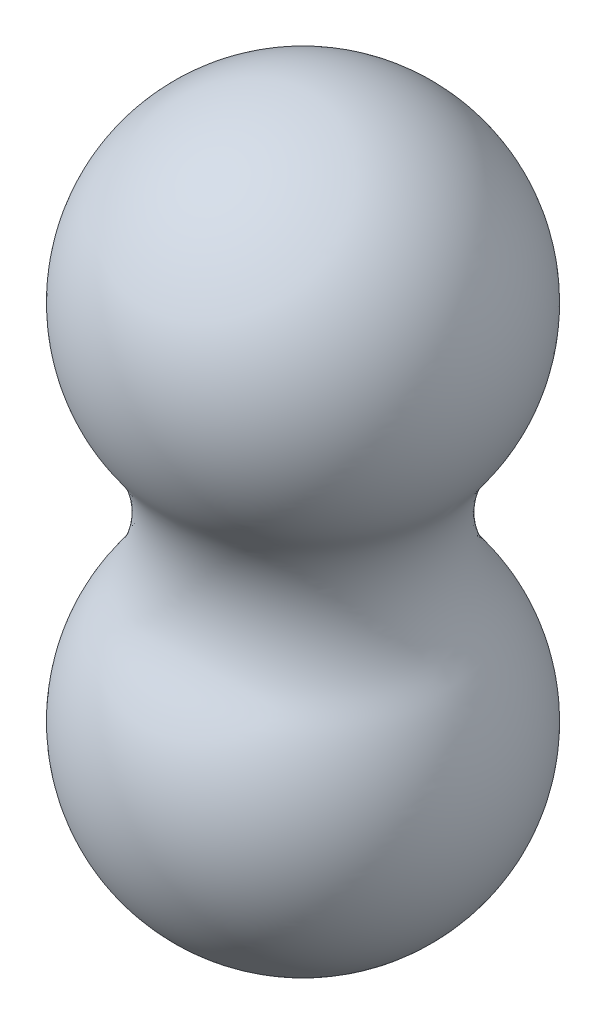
SolidWorks part; units mm, degrees
ref_plane "Płaszczyzna przednia" through (0, 0, 0) normal (0, 0, 1) x (1, 0, 0)
ref_plane "Płaszczyzna górna" through (0, 0, 0) normal (0, 1, 0) x (1, 0, 0)
ref_plane "Płaszczyzna prawa" through (0, 0, 0) normal (1, 0, 0) x (0, 0, -1)
sketch "Szkic5" plane through (0, 0, 0) normal (0, 0, 1) x (1, 0, 0)
  line L0 (0, 0) -> (0, 60)
  arc A0 (0, 60) -> (12, 36) centre (0, 45) cw construction
  arc A1 (12, 36) -> (12, 24) centre (20, 30) ccw construction
  arc A2 (12, 24) -> (0, 0) centre (0, 15) cw construction
  spline S0 degree 3 poles (0, 0) (12.1152, 0) (18.6714, 10.1879) (13.6521, 21.2145) (13.3557, 21.8658) (12.6695, 23.1258) (11.3377, 24.8498) (10.7394, 26.1589) (10.5132, 26.8377) (9.8229, 28.9086) (9.8229, 31.0914) (10.5132, 33.1623) (10.7394, 33.8411) (11.3377, 35.1502) (12.6695, 36.8742) (13.3557, 38.1342) (13.6521, 38.7855) (18.6714, 49.8121) (12.1152, 60) (0, 60) knots 0 0 0 0 0.362155 0.362155 0.362155 0.392971 0.423788 0.454604 0.454604 0.454604 0.545396 0.545396 0.545396 0.576212 0.607029 0.637845 0.637845 0.637845 1 1 1 1 weights 1 0.694104 0.694104 1 1 1 1 1 1 0.965789 0.965789 1 1 1 1 1 1 0.694104 0.694104 1
  point P8 (28.8338, 24.0923)
  point P9 (3.3487, 0)
  point P10 (33.5368, 76.3682)
  point P11 (32.2655, 84.0271)
  point P12 (0, 0)
  point P13 (9.9881, 59.1155)
  dimension "D1" = 15
  dimension "D2" = 10
  dimension "D3" = 15
  dimension "D4" = 60
revolve "Obrót1" add sketch "Szkic5" angle 360 about L0
